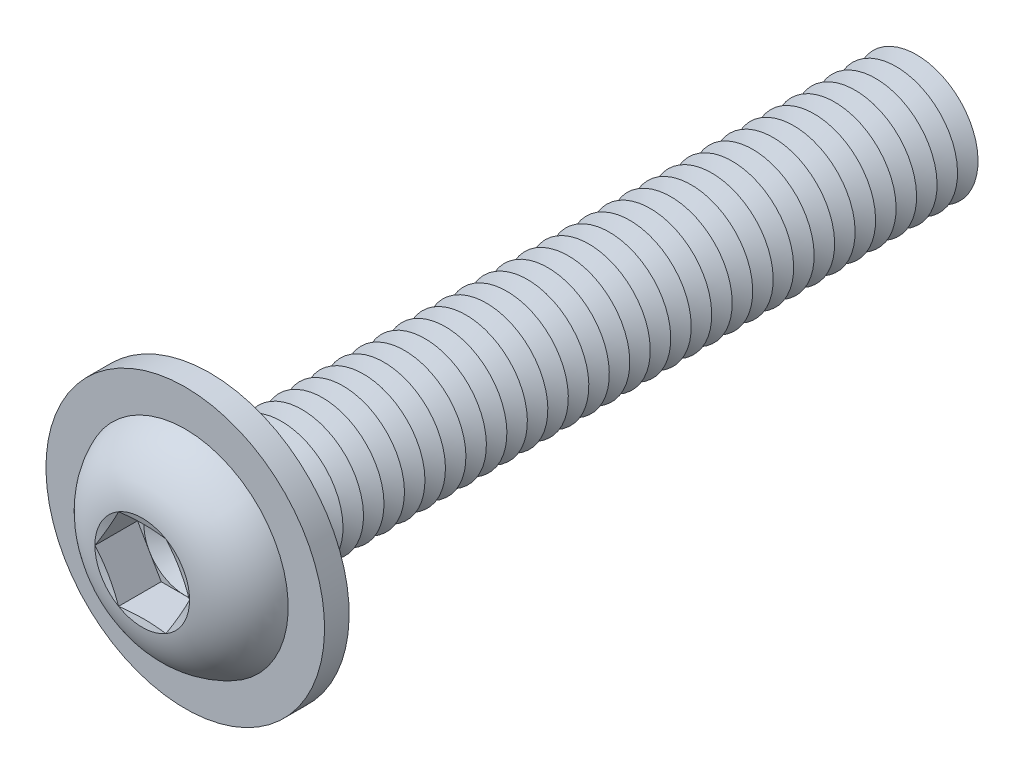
SolidWorks part; units mm, degrees
ref_plane "Front Plane" through (0, 0, 0) normal (0, 0, 1) x (1, 0, 0)
ref_plane "Top Plane" through (0, 0, 0) normal (0, 1, 0) x (1, 0, 0)
ref_plane "Right Plane" through (0, 0, 0) normal (1, 0, 0) x (0, 0, -1)
sketch "Sketch1" plane through (0, 0, 0) normal (1, 0, 0) x (0, 0, -1)
  line L0 (0, 3) -> (0, 5.25)
  line L3 (0, 3) -> (35, 3)
  line L4 (35, 3) -> (35, 0)
  line L5 (35, 0) -> (-3.3, 0) construction
  line L6 (-3.3, 0) -> (35, 0)
  line L7 (-3.3, 2.3094) -> (-3.3, 1.1547) construction
  line L8 (-3.3, 1.1547) -> (-3.3, 0)
  line L9 (-3.3, 2.3094) -> (-2.9906, 1.1547)
  line L10 (-2.9906, 1.1547) -> (-3.3, 1.1547)
  line L11 (35, 0) -> (22.7481, 0) construction
  line L12 (0, 5.25) -> (-3.3, 5.25) construction
  arc A1 (0, 5.25) -> (-3.3, 2.3094) centre (0, 1.928) ccw
  point P8 (35, 1.5)
  dimension "D1" = 10.5
  dimension "D2" = 6
  dimension "D3" = 3.3
  dimension "D4" = 4.6188
  dimension "D5" = 35
  dimension "D6" = 15
revolve "Revolve1" add sketch "Sketch1" angle 360 about L5
fillet "Fillet1" radius 0.5 1 edges at (0, 3, 0)
sketch "Sketch2" plane through (0, 0, 0) normal (1, 0, 0) x (0, 0, -1)
  line L0 (34.5, 3) -> (35.5, 3)
  line L1 (35, 3) -> (0.5, 3) construction
  line L2 (35.5, 3) -> (35, 2.134)
  line L3 (35, -3) -> (35, 3) construction
  line L4 (35, 2.134) -> (34.5, 3)
  dimension "D1" = 1
revolve "Cut-Revolve1" cut sketch "Sketch2" angle 360 about axis through (0, 0, -35) along (0, 0, -1)
pattern_linear "LPattern1" count 35 spacing 1 along (0, 0, 1) of "Cut-Revolve1"
sketch "Sketch3" plane through (0, 0, 3.3) normal (0, 0, 1) x (1, 0, 0)
  line L7 (1.1547, 2) -> (-1.1547, 2)
  line L8 (-1.1547, 2) -> (-2.3094, 0)
  line L9 (-2.3094, 0) -> (-1.1547, -2)
  line L10 (-1.1547, -2) -> (1.1547, -2)
  line L11 (1.1547, -2) -> (2.3094, 0)
  line L12 (2.3094, 0) -> (1.1547, 2)
  circle A0 centre (0, 0) radius 2 construction
  circle A3 centre (0, 0) radius 2.3094 construction
extrude "Cut-Extrude1" cut sketch "Sketch3" against normal blind 2.08
sketch "Sketch4" plane through (0, 0, 1.22) normal (0, 0, 1) x (1, 0, 0)
  line L1 (1.1547, 2) -> (-1.1547, 2) construction
  circle A0 centre (0, 0) radius 2
extrude "Cut-Extrude2" cut sketch "Sketch4" against normal through all draft 60
sketch "Sketch5" plane through (0, 0, 0) normal (0, 0, -1) x (-1, 0, 0)
  circle A0 centre (0, 0) radius 6.8
  circle A1 centre (0, 0) radius 3.5
  circle A2 centre (0, 0) radius 3.5 construction
  dimension "D1" = 13.6
extrude "Boss-Extrude1" add sketch "Sketch5" against normal blind 1.2
